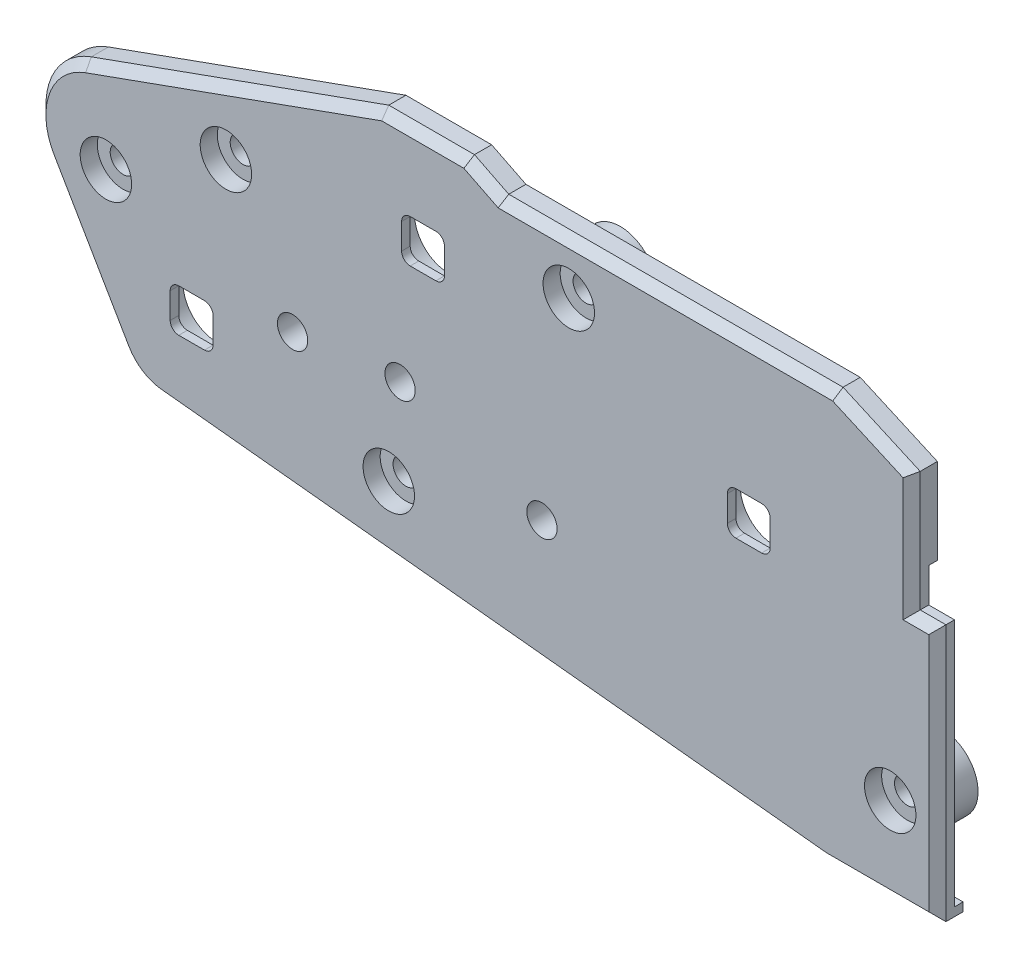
SolidWorks part; units mm, degrees
ref_plane "Face" through (0, 0, 0) normal (0, 0, 1) x (1, 0, 0)
ref_plane "Dessus" through (0, 0, 0) normal (0, 1, 0) x (1, 0, 0)
ref_plane "Droite" through (0, 0, 0) normal (1, 0, 0) x (0, 0, -1)
sketch "Esquisse1" plane through (0, 0, 0) normal (0, 0, 1) x (1, 0, 0)
  line L0 (0, 0) -> (0, 30)
  line L1 (0, 30) -> (-3, 30)
  line L2 (-3, 30) -> (-3, 44)
  line L3 (-3, 44) -> (-12, 48)
  line L4 (-12, 48) -> (-51, 48)
  line L5 (-12, 48) -> (-3, 48) construction
  line L6 (-3, 48) -> (-3, 44) construction
  line L7 (0, 0) -> (-13, 0)
  line L8 (-13, 0) -> (-90.6176, 8.0319)
  line L9 (-103.9138, 25.9752) -> (-95.1854, 10.9814)
  line L10 (-51, 48) -> (-55, 50)
  line L11 (-55, 50) -> (-65, 50)
  line L12 (-65, 50) -> (-99.7054, 37.5287)
  arc A0 (-90.6176, 8.0319) -> (-95.1854, 10.9814) centre (-90, 14) cw
  arc A1 (-99.7054, 37.5287) -> (-103.9138, 25.9752) centre (-97, 30) ccw
  dimension "D8" = 6
  dimension "D13" = 8
  dimension "D1" = 30
  dimension "D2" = 3
  dimension "D3" = 18
  dimension "D4" = 9
  dimension "D5" = 4
  dimension "D6" = 51
  dimension "D7" = 13
  dimension "D9" = 90
  dimension "D10" = 14
  dimension "D11" = 97
  dimension "D12" = 30
  dimension "D14" = 65
  dimension "D15" = 55
  dimension "D16" = 50
extrude "Plaque de base" add sketch "Esquisse1" along normal blind 2
chamfer "Chanfrein " distance 1 angle 45
sketch "Esquisse2" plane through (0, 0, 0) normal (0, 0, -1) x (-1, 0, 0)
  line L0 (3, 44) -> (3, 34)
  line L1 (3, 30) -> (3, 44) construction
  line L2 (0, 30) -> (3, 30) construction
  line L11 (0, 0) -> (13, 0)
  line L12 (13, 0) -> (90.6176, 8.0319)
  line L13 (95.1854, 10.9814) -> (103.9138, 25.9752)
  line L14 (99.7054, 37.5287) -> (65, 50)
  line L15 (65, 50) -> (55, 50)
  line L16 (55, 50) -> (51, 48)
  line L17 (51, 48) -> (12, 48)
  line L18 (12, 48) -> (3, 44)
  line L19 (3, 44) -> (3, 30)
  line L20 (3, 30) -> (0, 30)
  line L21 (0, 30) -> (0, 0)
  line L22 (0, 0) -> (13, 0)
  line L23 (13, 0) -> (90.6176, 8.0319)
  line L24 (95.1854, 10.9814) -> (103.9138, 25.9752)
  line L25 (99.7054, 37.5287) -> (65, 50)
  line L26 (65, 50) -> (55, 50)
  line L27 (55, 50) -> (51, 48)
  line L28 (51, 48) -> (12, 48)
  line L29 (12, 48) -> (3, 44)
  arc A2 (90.6176, 8.0319) -> (95.1854, 10.9814) centre (90, 14) ccw
  arc A3 (103.9138, 25.9752) -> (99.7054, 37.5287) centre (97, 30) ccw
  arc A4 (90.6176, 8.0319) -> (95.1854, 10.9814) centre (90, 14) ccw
  arc A5 (103.9138, 25.9752) -> (99.7054, 37.5287) centre (97, 30) ccw
  dimension "D2" = 4
  dimension "D1" = 0
extrude "Nervure" add sketch "Esquisse2" along normal blind 1 thin
sketch "Esquisse3" plane through (0, 0, 0) normal (0, 0, -1) x (-1, 0, 0)
  line L0 (3.15, 0) -> (-3.15, 0) construction
  line L1 (0, 3.15) -> (0, -3.15) construction
  circle A0 centre (5.5, 10) radius 4.25
  dimension "D3" = 8.5
  dimension "D1" = 10
  dimension "D2" = 5.5
extrude "Bossage 10" add sketch "Esquisse3" along normal blind 4
sketch "Esquisse4" plane through (0, 0, -4) normal (0, 0, -1) x (-1, 0, 0)
  circle A0 centre (5.5, 10) radius 3
  circle A1 centre (5.5, 10) radius 4.25 construction
  dimension "D1" = 6
extrude "Lamage 10" cut sketch "Esquisse4" against normal blind 2
sketch "Esquisse6" plane through (0, 0, 2) normal (0, 0, 1) x (1, 0, 0)
  circle A0 centre (-5.5, 10) radius 3
  circle A1 centre (-5.5, 10) radius 4.25 construction
  dimension "D1" = 6
extrude "Lamage 11" cut sketch "Esquisse6" against normal blind 2
sketch "Esquisse7" plane through (0, 0, -4) normal (0, 0, -1) x (-1, 0, 0)
  circle A0 centre (5.5, 10) radius 1.5
  circle A1 centre (5.5, 10) radius 4.25 construction
  dimension "D1" = 3
extrude "Passage 10" cut sketch "Esquisse7" against normal through all
sketch "Répét bossage 1" plane through (0, 0, 0) normal (0, 0, -1) x (-1, 0, 0)
  line L0 (0, 1) -> (0, 30) construction
  line L1 (0, 0) -> (13, 0) construction
  line L2 (0, 0) -> (13, 0) construction
  point P0 (64, 13)
  point P5 (43, 42)
  point P8 (83, 36)
  point P9 (97, 28)
  dimension "D1" = 64
  dimension "D2" = 13
  dimension "D3" = 43
  dimension "D4" = 42
  dimension "D5" = 36
  dimension "D6" = 83
  dimension "D7" = 97
  dimension "D8" = 28
pattern_sketch "Répét. bossage 1"
sketch "Esquisse9" plane through (0, 0, 0) normal (0, 0, 1) x (1, 0, 0)
  line L0 (0, -3.15) -> (0, 3.15) construction
  line L1 (3.15, 0) -> (-3.15, 0) construction
  circle A0 centre (-22, 30) radius 5.5
  dimension "D1" = 11
  dimension "D2" = 22
  dimension "D3" = 30
extrude "Bossage 20" add sketch "Esquisse9" against normal blind 1
sketch "Esquisse10" plane through (0, 0, -1) normal (0, 0, -1) x (-1, 0, 0)
  circle A0 centre (22, 30) radius 4
  circle A1 centre (22, 30) radius 5.5 construction
  dimension "D1" = 8
extrude "Lamage 20 " cut sketch "Esquisse10" against normal blind 2
sketch "Esquisse8" plane through (0, 0, 2) normal (0, 0, -1) x (-1, 0, 0)
  line L0 (19.5, 30) -> (22, 30) construction
  line L1 (20.5, 32.5) -> (23.5, 32.5)
  line L2 (19.5, 31.5) -> (19.5, 28.5)
  line L3 (20.5, 27.5) -> (23.5, 27.5)
  line L4 (24.5, 31.5) -> (24.5, 28.5)
  line L5 (22, 30) -> (22, 32.5) construction
  arc A0 (19.5, 31.5) -> (20.5, 32.5) centre (20.5, 31.5) cw
  arc A1 (20.5, 27.5) -> (19.5, 28.5) centre (20.5, 28.5) cw
  arc A2 (24.5, 28.5) -> (23.5, 27.5) centre (23.5, 28.5) cw
  arc A3 (23.5, 32.5) -> (24.5, 31.5) centre (23.5, 31.5) cw
  point P13 (19.5, 32.5)
  point P18 (24.5, 27.5)
  point P21 (24.5, 32.5)
  dimension "D5" = 1
  dimension "D1" = 5
  dimension "D2" = 5
extrude "Passage 20" cut sketch "Esquisse8" along normal through all
sketch "Répét bossage 2" plane through (0, 0, 0) normal (0, 0, -1) x (-1, 0, 0)
  line L0 (0, 3.15) -> (0, -3.15) construction
  line L1 (3.15, 0) -> (-3.15, 0) construction
  point P0 (60, 38.5)
  point P3 (87, 18)
  dimension "D1" = 60
  dimension "D2" = 87
  dimension "D3" = 38.5
  dimension "D4" = 18
pattern_sketch "Répét. bossage 2"
sketch "Esquisse12" plane through (0, 0, 0) normal (0, 0, -1) x (-1, 0, 0)
  line L0 (3.15, 0) -> (-3.15, 0) construction
  circle A0 centre (46.1309, 18) radius 3
  dimension "D1" = 6
  dimension "D2" = 18
  dimension "D3" = 26.95
extrude "Bossage 30" add sketch "Esquisse12" along normal blind 1
sketch "Esquisse13" plane through (0, 0, -1) normal (0, 0, -1) x (-1, 0, 0)
  circle A0 centre (46.1309, 18) radius 1.7689
  circle A1 centre (46.1309, 18) radius 3 construction
extrude "Passage 30" cut sketch "Esquisse13" against normal through all
sketch "Répét bossage 3" plane through (0, 0, 0) normal (0, 0, -1) x (-1, 0, 0)
  point P0 (62.6799, 23.6905)
  point P1 (75.221, 22.4739)
  dimension "D1" = 17.5
  dimension "D2" = 15.05
  dimension "D3" = 12.6
  dimension "D4" = 12.6
pattern_sketch "Répét. bossage 3"
